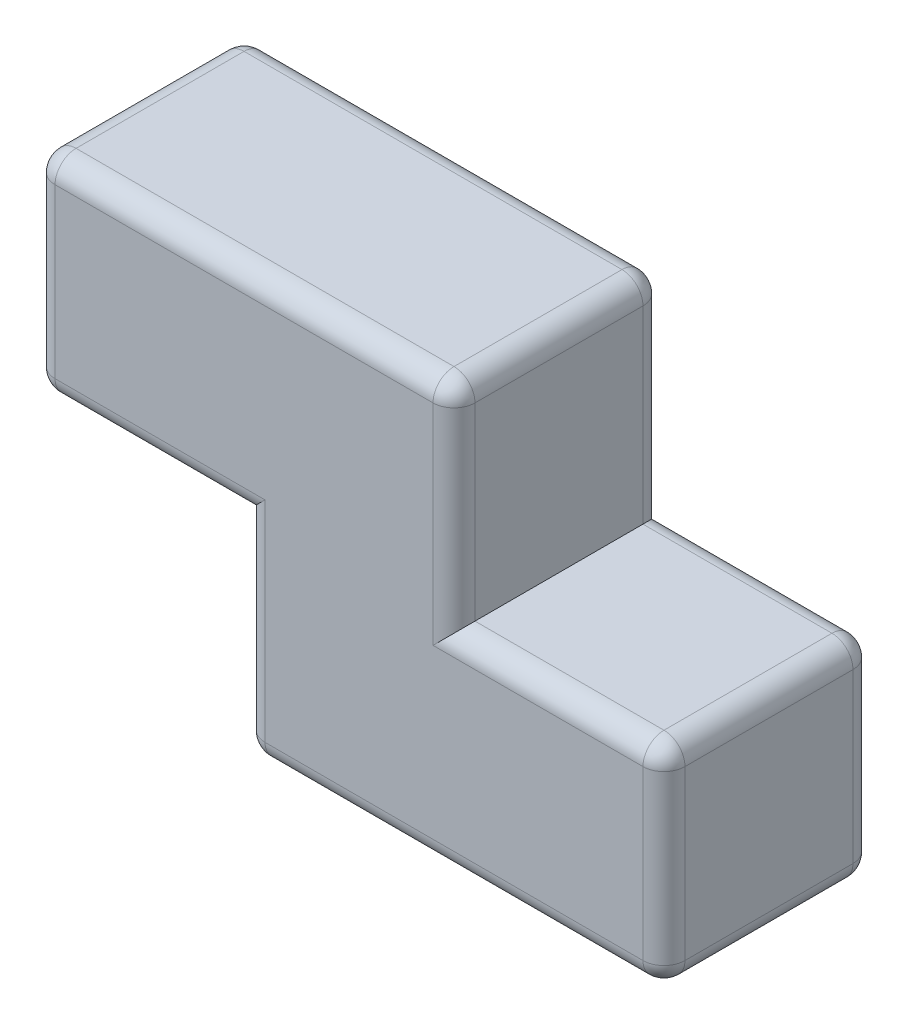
SolidWorks part; units mm, degrees
ref_plane "Front Plane" through (0, 0, 0) normal (0, 0, 1) x (1, 0, 0)
ref_plane "Top Plane" through (0, 0, 0) normal (0, 1, 0) x (1, 0, 0)
ref_plane "Right Plane" through (0, 0, 0) normal (1, 0, 0) x (0, 0, -1)
sketch "Sketch1" plane through (0, 0, 0) normal (0, 0, 1) x (1, 0, 0)
  line L1 (-326.4, 114.7403) -> (-126.4, 114.7403)
  line L2 (-326.4, 114.7403) -> (-326.4, 14.7403)
  line L3 (-326.4, 14.7403) -> (-226.4, 14.7403)
  line L4 (-126.4, 114.7403) -> (-126.4, 14.7403)
  line L11 (-226.4, 14.7403) -> (-226.4, -85.2597)
  line L12 (-226.4, -85.2597) -> (-126.4, -85.2597)
  line L15 (-126.4, 14.7403) -> (-26.4, 14.7403)
  line L17 (-126.4, -85.2597) -> (-26.4, -85.2597)
  line L18 (-26.4, 14.7403) -> (-26.4, -85.2597)
  dimension "D1" = 100
  dimension "D2" = 200
  dimension "D3" = 100
  dimension "D4" = 100
  dimension "D5" = 100
extrude "Boss-Extrude1" add sketch "Sketch1" along normal blind 100
fillet "Fillet3" radius 10 22 edges at (-276.4, 14.7403, 0) (-126.4, 64.7403, 0) (-326.4, 14.7403, 50) (-326.4, 64.7403, 0) (-126.4, 64.7403, 100) (-276.4, 14.7403, 100) (-326.4, 64.7403, 100) (-126.4, 114.7403, 50) (-226.4, 114.7403, 100) (-326.4, 114.7403, 50) (-226.4, 114.7403, 0) (-226.4, -35.2597, 0) (-126.4, -85.2597, 0) (-126.4, -85.2597, 100) (-226.4, -35.2597, 100) (-226.4, -85.2597, 50) (-26.4, -85.2597, 50) (-26.4, -35.2597, 0) (-76.4, 14.7403, 0) (-76.4, 14.7403, 100) (-26.4, -35.2597, 100) (-26.4, 14.7403, 50)
